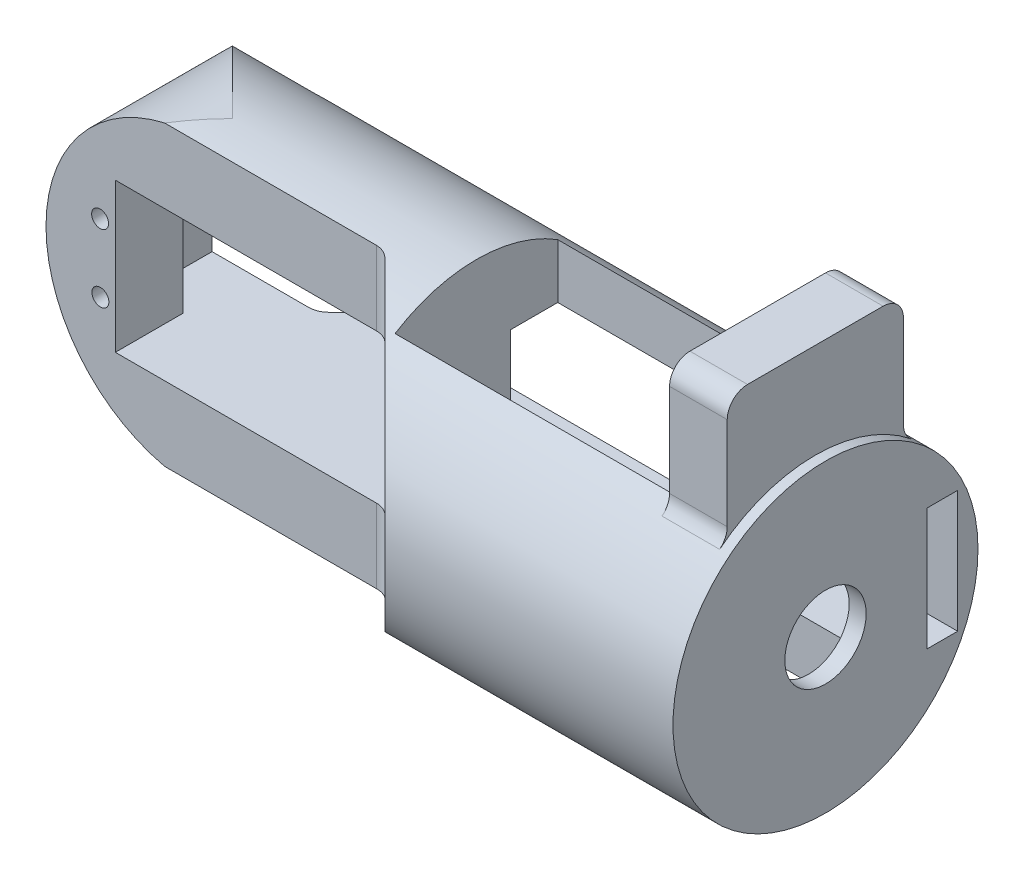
SolidWorks part; units mm, degrees
ref_plane "Front Plane" through (0, 0, 0) normal (0, 0, 1) x (1, 0, 0)
ref_plane "Top Plane" through (0, 0, 0) normal (0, 1, 0) x (1, 0, 0)
ref_plane "Right Plane" through (0, 0, 0) normal (1, 0, 0) x (0, 0, -1)
sketch "Sketch1" plane through (0, 0, 0) normal (1, 0, 0) x (0, 0, -1)
  circle A0 centre (0, 0) radius 22.5
  dimension "D1" = 45
extrude "Boss-Extrude1" add sketch "Sketch1" against normal blind 110
sketch "Sketch7" plane through (0, 0, 0) normal (0, 1, 0) x (1, 0, 0)
  line L1 (-2.5, -12) -> (-51.5, -12)
  line L2 (-2.5, -12) -> (-2.5, 12)
  line L3 (-2.5, 12) -> (-51.5, 12)
  line L4 (-51.5, -12) -> (-51.5, 12)
  line L5 (-2.5, -12) -> (-51.5, 12) construction
  line L6 (-2.5, 12) -> (-51.5, -12) construction
  point P0 (-27, 0)
  dimension "D1" = 2.5
  dimension "D2" = 24
  dimension "D3" = 49
extrude "Cut-Extrude5" cut sketch "Sketch7" against normal through all both and the other way through all
sketch "Sketch2" plane through (0, 0, 0) normal (0, 0, 1) x (1, 0, 0)
  line L0 (-110, 22.5) -> (-110, -22.5) construction
  line L1 (-60, -27.5) -> (-110, -27.5)
  line L2 (-60, -27.5) -> (-60, 27.5)
  line L3 (-60, 27.5) -> (-110, 27.5)
  line L4 (-110, -27.5) -> (-110, 27.5)
  line L5 (-60, -27.5) -> (-110, 27.5) construction
  line L6 (-60, 27.5) -> (-110, -27.5) construction
  point P0 (-85, 0)
  dimension "D1" = 60
  dimension "D2" = 55
extrude "Cut-Extrude1" cut sketch "Sketch2" against normal blind 20 from offset 25
sketch "Sketch3" plane through (0, 0, 5) normal (0, 0, 1) x (1, 0, 0)
  line L1 (-110, 21.9374) -> (-60, 21.9374) construction
  line L4 (-110, 22.5) -> (-110, -22.5) construction
  line L5 (-110, -22.5) -> (-51.5, -22.5) construction
  line L6 (-110, 21.9374) -> (-110, -21.9374) construction
  line L7 (-51.5, 22.5) -> (-110, 22.5) construction
  line L8 (-110, 22.5) -> (-110, -22.5)
  line L9 (-110, -22.5) -> (-51.5, -22.5)
  line L10 (-110, 21.9374) -> (-110, -21.9374)
  line L11 (-51.5, 22.5) -> (-110, 22.5)
  line L15 (-60, -21.9374) -> (-60, 21.9374) construction
  arc A1 (-87.5, 22.5) -> (-87.5, -22.5) centre (-87.5, 0) ccw
  dimension "D1" = 22.5
extrude "Cut-Extrude4" cut sketch "Sketch3" against normal through all both and the other way through all contours A1 M2 M3 | A1 L10 M4 | A1 L8 L9 M4 | A1 L11 L8 M2
ref_plane "Plane1" through (-27.5, 0, -27.5) normal (0.7071, 0, 0.7071) x (0, 1, 0)
sketch "Sketch5" plane through (-27.5, 0, -27.5) normal (0.7071, 0, 0.7071) x (0, 1, 0)
  line L1 (-21.9374, 45.9619) -> (21.9374, 45.9619) construction
  line L2 (-21.9374, 45.9619) -> (21.9374, 45.9619)
extrude "Cut-Extrude-Thin1" cut sketch "Sketch5" against normal blind 50 and the other way through all from offset 50 thin
sketch "Sketch12" plane through (0, 0, 0) normal (0, 0, 1) x (1, 0, 0)
  line L0 (-60, -21.9374) -> (-60, 21.9374) construction
  line L5 (-110, 27.5) -> (-90, 27.5)
  line L6 (-110, 27.5) -> (-110, -27.5)
  line L7 (-110, -27.5) -> (-90, -27.5)
  line L8 (-90, 27.5) -> (-90, -27.5)
  line L9 (-110, 27.5) -> (-90, -27.5) construction
  line L10 (-110, -27.5) -> (-90, 27.5) construction
  arc A1 (-92.5, 21.9374) -> (-92.5, -21.9374) centre (-87.5, 0) ccw construction
  point P0 (-100, 0)
  point P14 (-110, 0)
  point P18 (-60, 0)
  dimension "D1" = 55
  dimension "D2" = 20
extrude "Cut-Extrude10" cut sketch "Sketch12" along normal blind 10 from offset 25
ref_plane "Plane2" through (-37.5, 0, 37.5) normal (0.7071, 0, -0.7071) x (0, 1, 0)
sketch "Sketch13" plane through (-37.5, 0, 37.5) normal (0.7071, 0, -0.7071) x (0, 1, 0)
  line L1 (-16.7705, -74.2462) -> (16.9822, -74.2462)
  line L2 (-16.7705, -74.2462) -> (16.7705, -74.2462) construction
extrude "Cut-Extrude-Thin2" cut sketch "Sketch13" along normal blind 20 thin
sketch "Sketch14" plane through (0, 0, 0) normal (0, 0, 1) x (1, 0, 0)
  line L1 (-50.5, -11) -> (-105.5, -11)
  line L2 (-50.5, -11) -> (-50.5, 11)
  line L3 (-50.5, 11) -> (-105.5, 11)
  line L4 (-105.5, -11) -> (-105.5, 11)
  line L5 (-50.5, -11) -> (-105.5, 11) construction
  line L6 (-50.5, 11) -> (-105.5, -11) construction
  arc A4 (-92.5, 21.9374) -> (-92.5, -21.9374) centre (-87.5, 0) ccw construction
  point P0 (-78, 0)
  point P8 (-110, 0)
  dimension "D1" = 4.5
  dimension "D2" = 55
  dimension "D3" = 22
extrude "Cut-Extrude11" cut sketch "Sketch14" along normal offset from surface (20 mm away) 10 from offset 25
sketch "Sketch15" plane through (0, 0, 5) normal (0, 0, 1) x (1, 0, 0)
  circle A0 centre (-87.5, 0) radius 6
  arc A1 (-92.5, 21.9374) -> (-92.5, -21.9374) centre (-87.5, 0) ccw construction
  dimension "D1" = 12
extrude "Cut-Extrude12" cut sketch "Sketch15" against normal up to next
ref_plane "Plane3" through (-11.5, 0, 0) normal (1, 0, 0) x (0, 0, -1)
sketch "Sketch16" plane through (-11.5, 0, 0) normal (1, 0, 0) x (0, 0, -1)
  line L4 (-12, 19.0329) -> (-12, 30.0329)
  line L6 (-12, 30.0329) -> (12, 30.0329)
  line L7 (12, 30.0329) -> (12, 19.0329)
  line L8 (-13, 19.0329) -> (-13, 30.0329)
  line L9 (-13, 19.0329) -> (-13, 18.3644)
  line L10 (-13, 30.0329) -> (-13, 36.5329)
  line L11 (-13, 36.5329) -> (13, 36.5329)
  line L12 (13, 36.5329) -> (13, 18.3644)
  arc A3 (12, 19.0329) -> (-12, 19.0329) centre (0, 0) ccw construction
  arc A4 (12, 19.0329) -> (-12, 19.0329) centre (0, 0) ccw construction
  circle A5 centre (0, 0) radius 22.5 construction
  arc A6 (13, 18.3644) -> (12, 19.0329) centre (0, 0) ccw
  arc A7 (-12, 19.0329) -> (-13, 18.3644) centre (0, 0) ccw
  dimension "D1" = 11
  dimension "D2" = 1
  dimension "D3" = 1
  dimension "D4" = 17.5
extrude "Boss-Extrude2" add sketch "Sketch16" along normal up to vertex (9 mm away) from offset 1.5 contours A7 L4 L6 L7 A6 L12 L11 L10 L8 L9
sketch "Sketch17" plane through (-2.5, 0, 0) normal (1, 0, 0) x (0, 0, -1)
  line L6 (13, 36.5329) -> (13, 18.3644) construction
  line L7 (-13, 36.5329) -> (13, 36.5329) construction
  line L8 (-13, 18.3644) -> (-13, 36.5329) construction
  line L9 (13, 36.5329) -> (13, 18.3644)
  line L10 (-13, 36.5329) -> (13, 36.5329)
  line L11 (-13, 18.3644) -> (-13, 36.5329)
  circle A2 centre (0, 0) radius 22.5 construction
  arc A3 (13, 18.3644) -> (-13, 18.3644) centre (0, 0) ccw
extrude "Boss-Extrude3" add sketch "Sketch17" along normal blind 1
sketch "Sketch19" plane through (0, 0, 0) normal (1, 0, 0) x (0, 0, -1)
  circle A0 centre (0, 0) radius 6
  dimension "D1" = 12
extrude "Cut-Extrude13" cut sketch "Sketch19" against normal up to next
ref_plane "Plane4" through (-49, 0, 0) normal (1, 0, 0) x (0, 0, -1)
fillet "Fillet1" radius 3 1 edges at (-60, 0, 5)
fillet "Fillet2" radius 3 2 edges at (-90, -13.8853, -15) (-90, 13.8853, -15)
fillet "Fillet3" radius 3 4 edges at (-5.75, 18.3644, -13) (-5.75, 18.3644, 13) (-5.75, 36.5329, -13) (-5.75, 36.5329, 13)
hole_wizard "M3 Tapped Hole1" positions "Sketch24" profile "Sketch26" tap size "M3" standard "ISO"
sketch "Sketch24" plane through (0, 0, -5) normal (0, 0, -1) x (-1, 0, 0)
  line L0 (50.5, -11) -> (50.5, 11) construction
  line L1 (51.5, 11) -> (105.5, 11) construction
  point P13 (55.0198, 5.1272)
  point P15 (54.9807, -4.8727)
  point P17 (102.0195, 4.9432)
  point P19 (101.9803, -5.0567)
  dimension "D1" = 4.4807
  dimension "D2" = 4.5198
  dimension "D3" = 51.4803
  dimension "D4" = 51.5195
  dimension "D5" = 5.8728
  dimension "D6" = 6.0568
  dimension "D7" = 15.8727
  dimension "D8" = 16.0567
sketch "Sketch26" plane through (-55.0198, 5.1272, -5) normal (1, 0, 0) x (0, 1, 0)
  line L0 (0, 0) -> (0, 12.7511)
  line L1 (0, 12.7511) -> (1.25, 12)
  line L2 (1.25, 12) -> (1.25, 0)
  line L5 (1.25, 0) -> (0, 0)
  line L10 (0, 12.7511) -> (-1.25, 12) construction
  line L11 (0, -6.35) -> (0, 107.95) construction
  dimension "Tap Drill Dia." = 2.5
  dimension "Tap Drill Depth" = 12
  dimension "Drill Angle" = 118
hole_wizard "M3 Tapped Hole2" positions "Sketch27" profile "Sketch28" tap size "M3" standard "ISO"
sketch "Sketch27" plane through (-10, 0, 0) normal (-1, 0, 0) x (0, 0, 1)
  point P0 (-5, 32.5)
  point P3 (5, 32.5)
  point P6 (-5, -14.5)
  point P9 (5, -14.5)
sketch "Sketch28" plane through (-10, 32.5, -5) normal (0, 1, 0) x (0, 0, 1)
  line L0 (0, 0) -> (0, 8.2511)
  line L1 (0, 8.2511) -> (1.25, 7.5)
  line L2 (1.25, 7.5) -> (1.25, 0)
  line L5 (1.25, 0) -> (0, 0)
  line L10 (0, 8.2511) -> (-1.25, 7.5) construction
  line L11 (0, -6.35) -> (0, 107.95) construction
  dimension "Tap Drill Dia." = 2.5
  dimension "Tap Drill Depth" = 7.5
  dimension "Drill Angle" = 118
sketch "Sketch29" plane through (-50.5, 0, 0) normal (-1, 0, 0) x (0, 0, 1)
  line L1 (-19.5, -9) -> (-15, -9)
  line L2 (-19.5, -9) -> (-19.5, 9)
  line L3 (-19.5, 9) -> (-15, 9)
  line L4 (-15, -9) -> (-15, 9)
  line L5 (-19.5, -9) -> (-15, 9) construction
  line L6 (-19.5, 9) -> (-15, -9) construction
  arc A1 (-19.6278, 11) -> (-19.6278, -11) centre (0, 0) ccw construction
  point P0 (-17.25, 0)
  dimension "D1" = 3
  dimension "D2" = 3
  dimension "D3" = 18
extrude "Cut-Extrude15" cut sketch "Sketch29" against normal blind 97
sketch "Sketch30" plane through (-50.5, 0, 0) normal (-1, 0, 0) x (0, 0, 1)
  line L3 (-19.6278, -11) -> (-12, -11)
  line L4 (-12, -11) -> (-12, 11)
  line L5 (-12, 11) -> (-19.6278, 11)
  line L6 (-19.6278, -11) -> (-12, -11)
  line L8 (-12, 11) -> (-19.6278, 11)
  line L11 (-12, -11) -> (-12, 11)
  arc A1 (-19.6278, 11) -> (-19.6278, -11) centre (0, 0) ccw
  arc A2 (-19.6278, 11) -> (-19.6278, -11) centre (0, 0) ccw
  dimension "D1" = 0
extrude "Cut-Extrude16" cut sketch "Sketch30" against normal offset from surface (45.5 mm away) 5
sketch "Sketch31" plane through (0, 0, -5) normal (0, 0, -1) x (-1, 0, 0)
  line L5 (57.2698, 11) -> (57.2698, -11)
  line L6 (85.3722, -11) -> (5, -11) construction
  line L7 (5, 11) -> (85.3722, 11) construction
  line L8 (99.7695, 11) -> (99.7695, -11)
  line L9 (105.5, 11) -> (91.2426, 11) construction
  line L10 (91.2426, -11) -> (105.5, -11) construction
  line L11 (57.2698, 11) -> (99.7695, 11)
  line L12 (57.2698, -11) -> (99.7695, -11)
  circle A1 centre (55.0198, 5.1272) radius 1.25 construction
  circle A3 centre (102.0195, 4.9432) radius 1.25 construction
  dimension "D1" = 1
  dimension "D2" = 1
extrude "Cut-Extrude17" cut sketch "Sketch31" against normal through all
